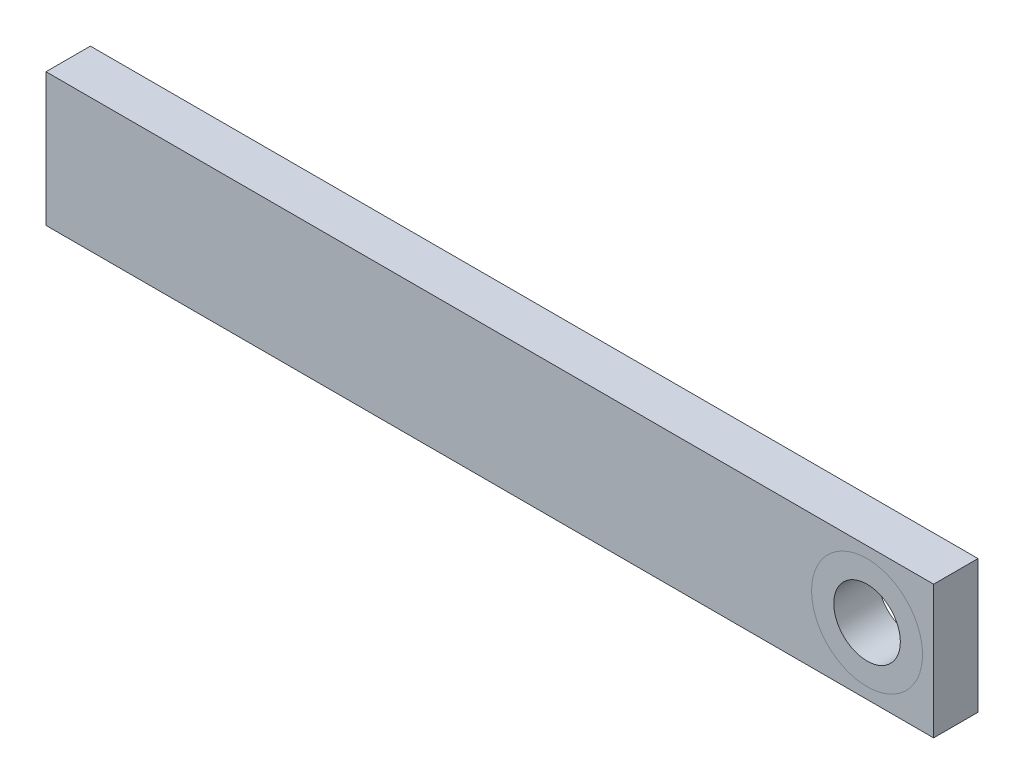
SolidWorks part; units mm, degrees
ref_plane "Front" through (0, 0, 0) normal (0, 0, 1) x (1, 0, 0)
ref_plane "Top" through (0, 0, 0) normal (0, 1, 0) x (1, 0, 0)
ref_plane "Right" through (0, 0, 0) normal (1, 0, 0) x (0, 0, -1)
sketch "Sketch1" plane through (0, 0, 0) normal (0, 0, 1) x (1, 0, 0)
  line L1 (0, 0) -> (200, 0)
  line L2 (0, 0) -> (0, 30)
  line L3 (0, 30) -> (200, 30)
  line L4 (200, 0) -> (200, 30)
  dimension "D1" = 200
  dimension "D2" = 30
extrude "Base-Extrude" add sketch "Sketch1" along normal blind 10
sketch "Sketch2" plane through (0, 0, 10) normal (0, 0, 1) x (1, 0, 0)
  line L0 (200, 30) -> (0, 30) construction
  line L1 (200, 0) -> (200, 30) construction
  line L2 (200, 0) -> (200, 30) construction
  circle A0 centre (185, 15) radius 7.5
  dimension "D1" = 15
  dimension "D3" = 15
  dimension "D2" = 15
extrude "Cut-Extrude1" cut sketch "Sketch2" against normal through all
sketch "Sketch3" plane through (0, 0, 10) normal (0, 0, 1) x (1, 0, 0)
  circle A0 centre (185, 15) radius 12.5
  circle A1 centre (185, 15) radius 7.5 construction
  dimension "D1" = 25
